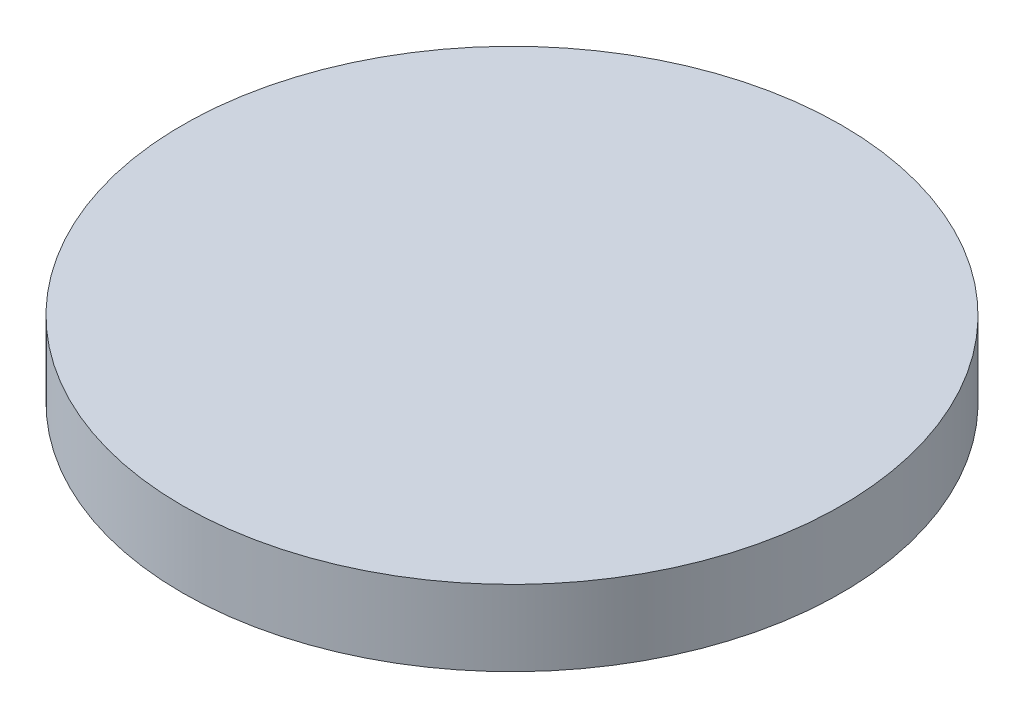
SolidWorks part; units mm, degrees
ref_plane "Front Plane" through (0, 0, 0) normal (0, 0, 1) x (1, 0, 0)
ref_plane "Top Plane" through (0, 0, 0) normal (0, 1, 0) x (1, 0, 0)
ref_plane "Right Plane" through (0, 0, 0) normal (1, 0, 0) x (0, 0, -1)
sketch "Sketch1" plane through (0, 0, 0) normal (0, 1, 0) x (1, 0, 0)
  circle A0 centre (0, 0) radius 87.2
extrude "Boss-Extrude1" add sketch "Sketch1" along normal blind 20
sketch "Sketch2" plane through (0, 20, 0) normal (0, 1, 0) x (1, 0, 0)
  line L0 (0, -146.3616) -> (0, 146.3616) construction
  line L1 (-119.4877, 0) -> (119.4877, 0) construction
  line L2 (-81.1904, 1.25) -> (81.1904, 1.25)
  line L3 (-79.5574, 16.25) -> (79.5574, 16.25)
  line L4 (-79.0056, 18.75) -> (79.0056, 18.75)
  line L5 (-73.8538, 33.75) -> (73.8538, 33.75)
  line L6 (72.6593, 36.25) -> (-72.6593, 36.25)
  line L7 (62.9832, 51.25) -> (-62.9832, 51.25)
  line L8 (60.8636, 53.75) -> (-60.8636, 53.75)
  line L9 (-43.2074, 68.75) -> (43.2074, 68.75)
  line L10 (-38.9471, 71.25) -> (38.9471, 71.25)
  line L11 (-38.9471, -71.25) -> (38.9471, -71.25)
  line L12 (-43.2074, -68.75) -> (43.2074, -68.75)
  line L13 (60.8636, -53.75) -> (-60.8636, -53.75)
  line L14 (62.9832, -51.25) -> (-62.9832, -51.25)
  line L15 (72.6593, -36.25) -> (-72.6593, -36.25)
  line L16 (-73.8538, -33.75) -> (73.8538, -33.75)
  line L17 (-79.0056, -18.75) -> (79.0056, -18.75)
  line L18 (-79.5574, -16.25) -> (79.5574, -16.25)
  line L19 (-81.1904, -1.25) -> (81.1904, -1.25)
  line L20 (-1.25, -81.1904) -> (-1.25, 81.1904)
  line L21 (-16.25, 79.5574) -> (-16.25, -79.5574)
  line L22 (-18.75, 79.0056) -> (-18.75, -79.0056)
  line L23 (-33.75, 73.8538) -> (-33.75, -73.8538)
  line L24 (-51.25, 62.9832) -> (-51.25, -62.9832)
  line L25 (-36.25, 72.6593) -> (-36.25, -72.6593)
  line L26 (-53.75, 60.8636) -> (-53.75, -60.8636)
  line L27 (-68.75, 43.2074) -> (-68.75, -43.2074)
  line L28 (-71.25, 38.9471) -> (-71.25, -38.9471)
  line L29 (71.25, 38.9471) -> (71.25, -38.9471)
  line L30 (68.75, 43.2074) -> (68.75, -43.2074)
  line L31 (53.75, 60.8636) -> (53.75, -60.8636)
  line L32 (51.25, 62.9832) -> (51.25, -62.9832)
  line L33 (36.25, 72.6593) -> (36.25, -72.6593)
  line L34 (33.75, 73.8538) -> (33.75, -73.8538)
  line L35 (18.75, 79.0056) -> (18.75, -79.0056)
  line L36 (16.25, 79.5574) -> (16.25, -79.5574)
  line L37 (1.25, -81.1904) -> (1.25, 81.1904)
  circle A0 centre (0, 0) radius 84.2
  circle A1 centre (0, 0) radius 87.2 construction
  circle A2 centre (0, 0) radius 87.2
  circle A3 centre (0, 0) radius 81.2
  point P9 (0, 0)
  point P12 (0, 0)
equation "\"GrooveOutside\"= 3"
equation "\"GrooveInside\"= 2.5"
equation "\"PlateDiameter\"= 174.4"
equation "\"D1@Sketch1\"=\"PlateDiameter\""
equation "\"D1@Sketch2\"=\"PlateDiameter\"-\"GrooveOutside\"*2"
equation "\"D2@Sketch2\"=\"PlateDiameter\"-\"GrooveOutside\"*4"
equation "\"D3@Sketch2\"=\"GrooveInside\"/2"
equation "\"SquareWidth\"= 15"
equation "\"D4@Sketch2\"=\"SquareWidth\""
equation "\"D5@Sketch2\"=\"GrooveInside\""
equation "\"D6@Sketch2\"=\"SquareWidth\""
equation "\"D7@Sketch2\"=\"GrooveInside\""
equation "\"D8@Sketch2\"=\"SquareWidth\""
equation "\"D9@Sketch2\"=\"GrooveInside\""
equation "\"D10@Sketch2\"=\"SquareWidth\""
equation "\"D12@Sketch2\"=\"GrooveInside\"/2"
equation "\"D13@Sketch2\"=\"SquareWidth\""
equation "\"D14@Sketch2\"=\"GrooveInside\""
equation "\"D15@Sketch2\"=\"GrooveInside\""
equation "\"D16@Sketch2\"=\"SquareWidth\""
equation "\"D17@Sketch2\"=\"GrooveInside\""
equation "\"D20@Sketch2\"=\"GrooveInside\""
equation "\"D19@Sketch2\"=\"SquareWidth\""
equation "\"D18@Sketch2\"=\"SquareWidth\""
